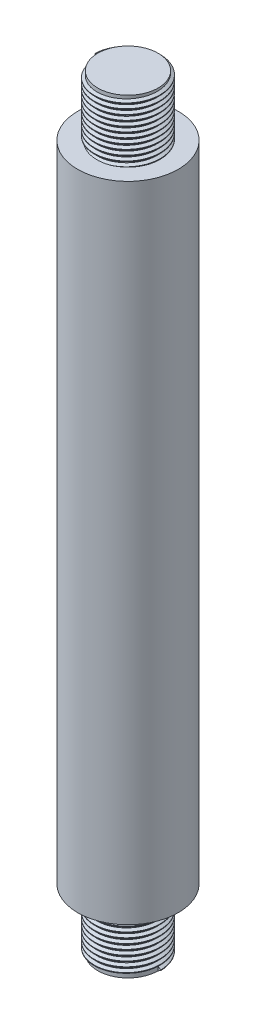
SolidWorks part; units mm, degrees
ref_plane "Front Plane" through (0, 0, 0) normal (0, 0, 1) x (1, 0, 0)
ref_plane "Top Plane" through (0, 0, 0) normal (0, 1, 0) x (1, 0, 0)
ref_plane "Right Plane" through (0, 0, 0) normal (1, 0, 0) x (0, 0, -1)
sketch "Outer Pipe" plane through (0, 0, 0) normal (0, 1, 0) x (1, 0, 0)
  circle A0 centre (0, 0) radius 15.875
  dimension "D1" = 31.75
extrude "BE - Outer Pipe" add sketch "Outer Pipe" along normal mid plane 203.2
sketch "End Part" plane through (0, 0, 0) normal (0, 1, 0) x (1, 0, 0)
  circle A0 centre (0, 0) radius 9.525
  dimension "D1" = 19.05
extrude "BE - End Part" add sketch "End Part" along normal mid plane 241.3
thread "Thread1" pitch 1.5875 start angle 0, offset 0, length 19.05, pitch 1.5875, diameter 19.05
ref_plane "Plane1" through (-9.525, 120.65, 0) normal (0, 0, 1) x (-1, 0, 0)
sketch "Thread Profile1" plane through (-9.525, 120.65, 0) normal (0, 0, 1) x (-1, 0, 0)
  line L0 (0, 0) -> (0, 1.5875) construction
  line L1 (0, 0) -> (0.8593, 0.4961)
  line L2 (0.8593, 0.4961) -> (0.8593, 0.6945)
  line L3 (0.8593, 0.6945) -> (0, 1.1906)
  line L4 (0.8593, 0.5953) -> (0, 0.5953) construction
  line L11 (0, 0) -> (0, 1.1906)
  point P2 (0, 0)
  dimension "Pitch" = 1.5875
  dimension "Profile_Angle" = 60
  dimension "Profile_Land" = 0.1984
  dimension "Profile_Height" = 0.8593
thread "Thread2" pitch 1.5875 start angle 0, offset 0, length 19.05, pitch 1.5875, diameter 19.05
ref_plane "Plane2" through (9.525, -120.65, 0) normal (0, 0, 1) x (1, 0, 0)
sketch "Thread Profile2" plane through (9.525, -120.65, 0) normal (0, 0, 1) x (1, 0, 0)
  line L0 (0, 0) -> (0, 1.5875) construction
  line L1 (0, 0) -> (0.8593, 0.4961)
  line L2 (0.8593, 0.4961) -> (0.8593, 0.6945)
  line L3 (0.8593, 0.6945) -> (0, 1.1906)
  line L4 (0.8593, 0.5953) -> (0, 0.5953) construction
  line L11 (0, 0) -> (0, 1.1906)
  point P2 (0, 0)
  dimension "Pitch" = 1.5875
  dimension "Profile_Angle" = 60
  dimension "Profile_Land" = 0.1984
  dimension "Profile_Height" = 0.8593
